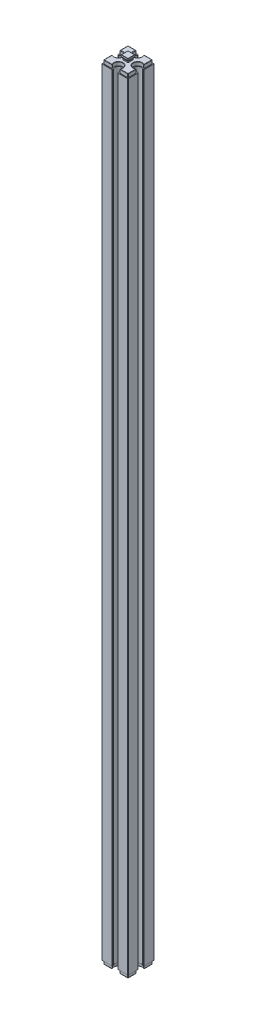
SolidWorks part; units mm, degrees
ref_plane "前视基准面" through (0, 0, 0) normal (0, 0, 1) x (1, 0, 0)
ref_plane "上视基准面" through (0, 0, 0) normal (0, 1, 0) x (1, 0, 0)
ref_plane "右视基准面" through (0, 0, 0) normal (1, 0, 0) x (0, 0, -1)
sketch "草图1" plane through (0, 0, 0) normal (0, 1, 0) x (1, 0, 0)
  line L0 (0, 0) -> (0, 7.5) construction
  line L1 (0, 0) -> (7.5, 0) construction
  line L2 (-7.5, 7.5) -> (-1.5, 7.5)
  line L3 (7.5, 7.5) -> (7.5, 1.5)
  line L4 (6.8229, 1.5) -> (7.5, 1.5)
  line L5 (6.8229, -1.5) -> (7.5, -1.5)
  line L6 (0, 7.5) -> (0, 5.5) construction
  line L7 (-1.5, 6.8229) -> (-1.5, 7.5)
  line L8 (1.5, 6.8229) -> (1.5, 7.5)
  line L9 (1.5, 7.5) -> (7.5, 7.5)
  line L10 (7.5, -1.5) -> (7.5, -7.5)
  line L11 (7.5, -7.5) -> (1.5, -7.5)
  line L12 (1.5, -6.8229) -> (1.5, -7.5)
  line L13 (-1.5, -6.8229) -> (-1.5, -7.5)
  line L14 (-1.5, -7.5) -> (-7.5, -7.5)
  line L15 (-7.5, -7.5) -> (-7.5, -1.5)
  line L16 (-6.8229, -1.5) -> (-7.5, -1.5)
  line L17 (-6.8229, 1.5) -> (-7.5, 1.5)
  line L18 (-7.5, 1.5) -> (-7.5, 7.5)
  arc A0 (-1.5, 6.8229) -> (1.5, 6.8229) centre (0, 5.5) ccw
  arc A1 (6.8229, 1.5) -> (6.8229, -1.5) centre (5.5, 0) ccw
  arc A2 (1.5, -6.8229) -> (-1.5, -6.8229) centre (0, -5.5) ccw
  arc A3 (-6.8229, -1.5) -> (-6.8229, 1.5) centre (-5.5, 0) ccw
  point P36 (0, 0)
  dimension "D6" = 4
  dimension "D7" = 2
  dimension "D1" = 7.5
  dimension "D2" = 7.5
  dimension "D3" = 2
  dimension "D4" = 7.5
  dimension "D5" = 1.5
extrude "凸台-拉伸1" add sketch "草图1" along normal blind 223
sketch "草图2" plane through (0, 223, 0) normal (0, 1, 0) x (1, 0, 0)
  line L0 (-7, 7) -> (-7, 2)
  line L1 (-7, 2) -> (-7, 2)
  line L2 (-7, -2) -> (-7, -2)
  line L3 (-7, -2) -> (-7, -7)
  line L4 (-7, -7) -> (-2, -7)
  line L5 (-2, -7) -> (-2, -7)
  line L6 (2, -7) -> (2, -7)
  line L7 (2, -7) -> (7, -7)
  line L8 (7, -7) -> (7, -2)
  line L9 (7, -2) -> (7, -2)
  line L10 (7, 2) -> (7, 2)
  line L11 (7, 2) -> (7, 7)
  line L12 (7, 7) -> (2, 7)
  line L13 (2, 7) -> (2, 7)
  line L14 (-2, 7) -> (-2, 7)
  line L15 (-2, 7) -> (-7, 7)
  line L16 (-7.5, 7.5) -> (-7.5, 1.5)
  line L17 (-7.5, 1.5) -> (-6.8229, 1.5)
  line L18 (-6.8229, -1.5) -> (-7.5, -1.5)
  line L19 (-7.5, -1.5) -> (-7.5, -7.5)
  line L20 (-7.5, -7.5) -> (-1.5, -7.5)
  line L21 (-1.5, -7.5) -> (-1.5, -6.8229)
  line L22 (1.5, -6.8229) -> (1.5, -7.5)
  line L23 (1.5, -7.5) -> (7.5, -7.5)
  line L24 (7.5, -7.5) -> (7.5, -1.5)
  line L25 (7.5, -1.5) -> (6.8229, -1.5)
  line L26 (6.8229, 1.5) -> (7.5, 1.5)
  line L27 (7.5, 1.5) -> (7.5, 7.5)
  line L28 (7.5, 7.5) -> (1.5, 7.5)
  line L29 (1.5, 7.5) -> (1.5, 6.8229)
  line L30 (-1.5, 6.8229) -> (-1.5, 7.5)
  line L31 (-1.5, 7.5) -> (-7.5, 7.5)
  line L32 (-7.5, 7.5) -> (-7.5, 1.5) construction
  line L33 (-7.5, 1.5) -> (-6.8229, 1.5) construction
  line L34 (-6.8229, -1.5) -> (-7.5, -1.5) construction
  line L35 (-7.5, -1.5) -> (-7.5, -7.5) construction
  line L36 (-7.5, -7.5) -> (-1.5, -7.5) construction
  line L37 (-1.5, -7.5) -> (-1.5, -6.8229) construction
  line L38 (1.5, -6.8229) -> (1.5, -7.5) construction
  line L39 (1.5, -7.5) -> (7.5, -7.5) construction
  line L40 (7.5, -7.5) -> (7.5, -1.5) construction
  line L41 (7.5, -1.5) -> (6.8229, -1.5) construction
  line L42 (6.8229, 1.5) -> (7.5, 1.5) construction
  line L43 (7.5, 1.5) -> (7.5, 7.5) construction
  line L44 (7.5, 7.5) -> (1.5, 7.5) construction
  line L45 (1.5, 7.5) -> (1.5, 6.8229) construction
  line L46 (-1.5, 6.8229) -> (-1.5, 7.5) construction
  line L47 (-1.5, 7.5) -> (-7.5, 7.5) construction
  arc A0 (-7, -2) -> (-7, 2) centre (-5.5, 0) ccw
  arc A1 (2, -7) -> (-2, -7) centre (0, -5.5) ccw
  arc A2 (7, 2) -> (7, -2) centre (5.5, 0) ccw
  arc A3 (-2, 7) -> (2, 7) centre (0, 5.5) ccw
  arc A4 (-6.8229, -1.5) -> (-6.8229, 1.5) centre (-5.5, 0) ccw
  arc A5 (1.5, -6.8229) -> (-1.5, -6.8229) centre (0, -5.5) ccw
  arc A6 (6.8229, 1.5) -> (6.8229, -1.5) centre (5.5, 0) ccw
  arc A7 (-1.5, 6.8229) -> (1.5, 6.8229) centre (0, 5.5) ccw
  arc A8 (-6.8229, -1.5) -> (-6.8229, 1.5) centre (-5.5, 0) ccw construction
  arc A9 (1.5, -6.8229) -> (-1.5, -6.8229) centre (0, -5.5) ccw construction
  arc A10 (6.8229, 1.5) -> (6.8229, -1.5) centre (5.5, 0) ccw construction
  arc A11 (-1.5, 6.8229) -> (1.5, 6.8229) centre (0, 5.5) ccw construction
  dimension "D1" = 0
  dimension "D2" = 0.5
extrude "凸台-拉伸2" add sketch "草图2" along normal blind 2
sketch "草图3" plane through (0, 0, 0) normal (1, 0, 0) x (0, 0, -1)
  line L0 (0, 225) -> (0, 227) construction
  line L1 (2.5, 225) -> (-2.5, 225) construction
  line L2 (0, 227) -> (0, 227.5) construction
  line L3 (-1.5, 225) -> (1.5, 225)
  line L4 (1.5, 225) -> (1.5, 225.6771)
  line L5 (-1.95, 227.5) -> (1.95, 227.5)
  line L6 (1.95, 227.5) -> (1.95, 226.5556)
  line L7 (-1.5, 225) -> (-1.5, 225.6771)
  line L8 (-1.95, 227.5) -> (-1.95, 226.5556)
  arc A0 (-1.5, 225.6771) -> (-1.95, 226.5556) centre (0, 227) cw
  arc A1 (1.5, 225.6771) -> (1.95, 226.5556) centre (0, 227) ccw
  dimension "D5" = 2
  dimension "D1" = 2
  dimension "D2" = 0.5
  dimension "D3" = 1.5
  dimension "D4" = 1.95
extrude "凸台-拉伸3" add sketch "草图3" along normal blind 2 and the other way blind 2
sketch "草图4" plane through (0, 0, 0) normal (0, 0, 1) x (1, 0, 0)
  line L0 (0, 225) -> (0, 227) construction
  line L2 (-2, 225) -> (2, 225) construction
  line L3 (0, 227) -> (0, 227.5) construction
  line L4 (-2, 227.5) -> (2, 227.5) construction
  line L5 (1.95, 227.5) -> (2, 227.5)
  line L6 (-1.95, 227.5) -> (-1.95, 226.5556)
  line L9 (-1.5, 225) -> (-1.5, 225.6771)
  line L10 (1.5, 225) -> (1.5, 225.6771)
  line L11 (1.95, 227.5) -> (1.95, 226.5556)
  line L12 (1.5, 225) -> (2, 225)
  line L13 (-2, 227.5) -> (-1.95, 227.5)
  line L14 (-2, 227.5) -> (-2, 225)
  line L15 (-2, 225) -> (-1.5, 225)
  line L16 (2, 227.5) -> (2, 225)
  arc A0 (-1.95, 226.5556) -> (-1.5, 225.6771) centre (0, 227) ccw
  arc A1 (1.95, 226.5556) -> (1.5, 225.6771) centre (0, 227) cw
  dimension "D1" = 2
  dimension "D2" = 1.5
  dimension "D3" = 1.95
fillet "圆角3" radius 0.2 13 edges at (-1.5, 111.5, -7.5) (1.5, 111.5, -7.5) (7.5, 111.5, -7.5) (7.5, 111.5, -1.5) (7.5, 111.5, 1.5) (7.5, 111.5, 7.5) (-1.5, 111.5, 7.5) (1.5, 111.5, 7.5) (-6.8229, 111.5, -1.5) (-7.5, 111.5, 7.5) (-7.5, 111.5, 1.5) (-7.5, 111.5, -1.5) (-7.5, 111.5, -7.5)
extrude "切除-拉伸1" cut sketch "草图4" against normal blind 3 and the other way blind 3
fillet "圆角4" radius 0.2 24 edges at (0, 225, 3) (-3, 225, 0) (0, 225, -3) (3, 225, 0) (7, 224, 2) (7, 224, -2) (2, 224, -7) (-2, 224, -7) (-7, 224, 2) (-7, 224, -2) (2, 224, 7) (-2, 224, 7) (7, 224, 7) (4.5, 225, 7) (7, 225, 4.5) (7, 225, -4.5) (7, 224, -7) (4.5, 225, -7) (-4.5, 225, -7) (-7, 224, -7) (-7, 225, -4.5) (-4.5, 225, 7) (-7, 225, 4.5) (-7, 224, 7)
fillet "圆角5" radius 0.1 4 edges at (0, 227.5, -1.95) (1.95, 227.5, 0) (0, 227.5, 1.95) (-1.95, 227.5, 0)
mirror "镜向1" of "圆角5", "圆角4", "切除-拉伸1", "圆角3", "凸台-拉伸3", "凸台-拉伸2", "凸台-拉伸1"
